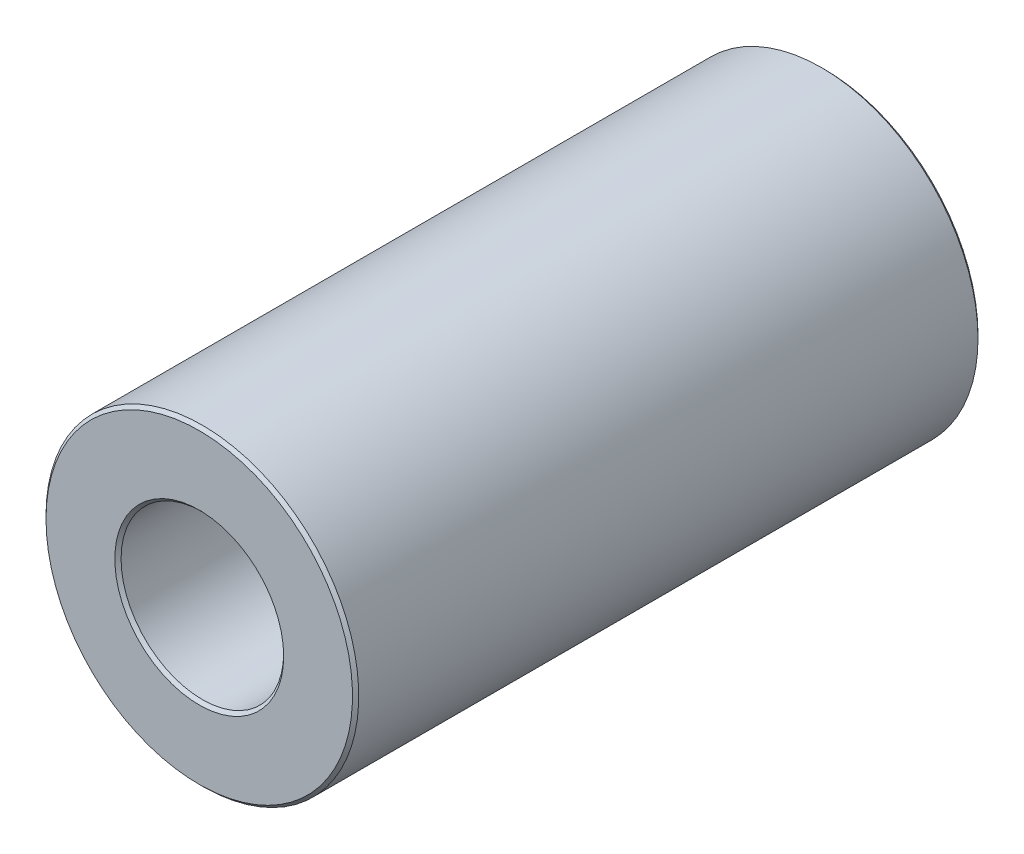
SolidWorks part; units mm, degrees
ref_plane "Front Plane" through (0, 0, 0) normal (0, 0, 1) x (1, 0, 0)
ref_plane "Top Plane" through (0, 0, 0) normal (0, 1, 0) x (1, 0, 0)
ref_plane "Right Plane" through (0, 0, 0) normal (1, 0, 0) x (0, 0, -1)
sketch "Sketch1" plane through (0, 0, 0) normal (0, 0, 1) x (1, 0, 0)
  circle A0 centre (0, 0) radius 5
  circle A1 centre (0, 0) radius 2.6
  dimension "D1" = 10
  dimension "D2" = 5.2
extrude "Boss-Extrude2" add sketch "Sketch1" along normal mid plane 20
chamfer "Chamfer3" distance 0.1 angle 45 4 edges at (5, 0, 10) (5, 0, -10) (2.6, 0, -10) (2.6, 0, 10)
